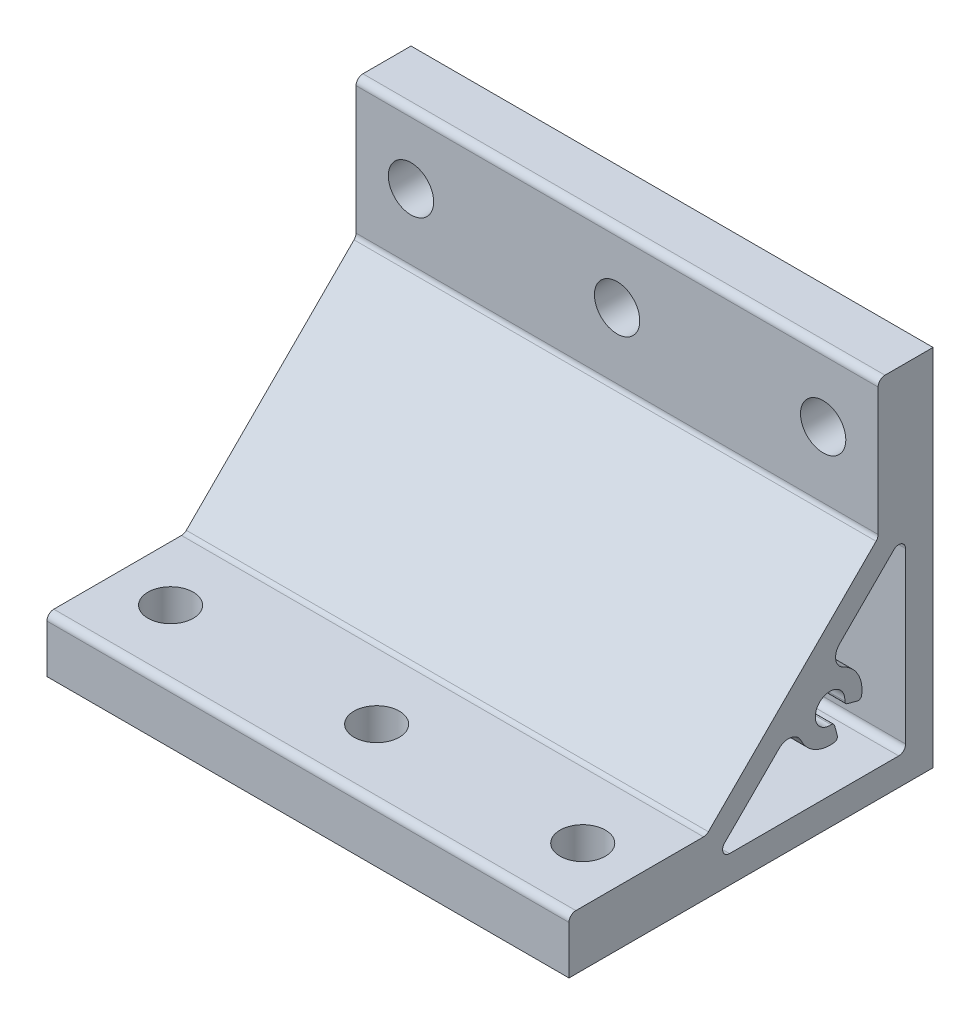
SolidWorks part; units mm, degrees
ref_plane "正面" through (0, 0, 0) normal (0, 0, 1) x (1, 0, 0)
ref_plane "平面" through (0, 0, 0) normal (0, 1, 0) x (1, 0, 0)
ref_plane "右側面" through (0, 0, 0) normal (1, 0, 0) x (0, 0, -1)
sketch "ｽｹｯﾁ1" plane through (0, 0, 0) normal (1, 0, 0) x (0, 0, -1)
  line L0 (0, 0) -> (0, 53)
  line L1 (-8, 33.4142) -> (-8, 52)
  line L2 (-52, 8) -> (-33.4142, 8)
  line L3 (-53, 0) -> (0, 0)
  line L4 (-53, 0) -> (-53, 7)
  line L5 (-8.2929, 32.7071) -> (-32.7071, 8.2929)
  line L6 (-29.636, 4) -> (-5, 4)
  line L7 (-22.4428, 13.6074) -> (-30.3431, 5.7071)
  line L8 (-4, 5) -> (-4, 29.636)
  line L9 (-11.0206, 13.9337) -> (-12.4863, 14.3264)
  line L10 (-13.9337, 11.0206) -> (-14.3264, 12.4863)
  line L11 (-5.7071, 30.3431) -> (-13.6074, 22.4428)
  line L12 (-7, 53) -> (0, 53)
  arc A0 (-52, 8) -> (-53, 7) centre (-52, 7) ccw
  arc A1 (-19.2155, 13.0373) -> (-14.3464, 10.3962) centre (-15, 15) ccw
  arc A2 (-30.3431, 5.7071) -> (-29.636, 4) centre (-29.636, 5) ccw
  arc A3 (-33.4142, 8) -> (-32.7071, 8.2929) centre (-33.4142, 9) ccw
  arc A4 (-19.2155, 13.0373) -> (-22.4428, 13.6074) centre (-21.0286, 12.1932) ccw
  arc A5 (-10.3962, 14.3464) -> (-13.0373, 19.2155) centre (-15, 15) ccw
  arc A6 (-14.3464, 10.3962) -> (-13.9337, 11.0206) centre (-14.4167, 10.8912) ccw
  arc A7 (-12.8556, 14.8454) -> (-12.4863, 14.3264) centre (-12.3569, 14.8094) ccw
  arc A8 (-12.8556, 14.8454) -> (-14.8454, 12.8556) centre (-15, 15) ccw
  arc A9 (-14.3264, 12.4863) -> (-14.8454, 12.8556) centre (-14.8094, 12.3569) ccw
  arc A10 (-11.0206, 13.9337) -> (-10.3962, 14.3464) centre (-10.8912, 14.4167) ccw
  arc A11 (-5, 4) -> (-4, 5) centre (-5, 5) ccw
  arc A12 (-13.6074, 22.4428) -> (-13.0373, 19.2155) centre (-12.1932, 21.0286) ccw
  arc A13 (-8.2929, 32.7071) -> (-8, 33.4142) centre (-9, 33.4142) ccw
  arc A14 (-4, 29.636) -> (-5.7071, 30.3431) centre (-5, 29.636) ccw
  arc A15 (-7, 53) -> (-8, 52) centre (-7, 52) ccw
extrude "押し出し1" add sketch "ｽｹｯﾁ1" along normal mid plane 76
hole_wizard "Ø6.6 (6.6) 直径の穴1" positions "3Dｽｹｯﾁ1" profile "ｽｹｯﾁ2" hole size "Ø6.6" standard "JIS"
sketch3d "3Dｽｹｯﾁ1"
  line L0 (-38, 52, 8) -> (-38, 33.4142, 8) construction
  line L1 (38, 52, 8) -> (-38, 52, 8) construction
  line L2 (-38, 8, 33.4142) -> (-38, 8, 52) construction
  line L3 (38, 8, 52) -> (-38, 8, 52) construction
  point P0 (-30, 8, 43)
  point P2 (0, 8, 43)
  point P4 (30, 8, 43)
  point P6 (-30, 43, 8)
  point P8 (0, 43, 8)
  point P10 (30, 43, 8)
  dimension "D1" = 8
  dimension "D2" = 30
  dimension "D3" = 30
  dimension "D4" = 9
  dimension "D5" = 30
  dimension "D6" = 30
  dimension "D7" = 8
  dimension "D8" = 9
sketch "ｽｹｯﾁ2" plane through (-30, 8, 43) normal (1, 0, 0) x (0, 0, 1)
  line L0 (0, 0) -> (0, 8)
  line L1 (0, 8) -> (3.3, 8)
  line L2 (3.3, 8) -> (3.3, 0)
  line L5 (3.3, 0) -> (0, 0)
  line L11 (0, -6.35) -> (0, 107.95) construction
  dimension "通し穴の直径" = 6.6
  dimension "通し穴の深さ" = 8
